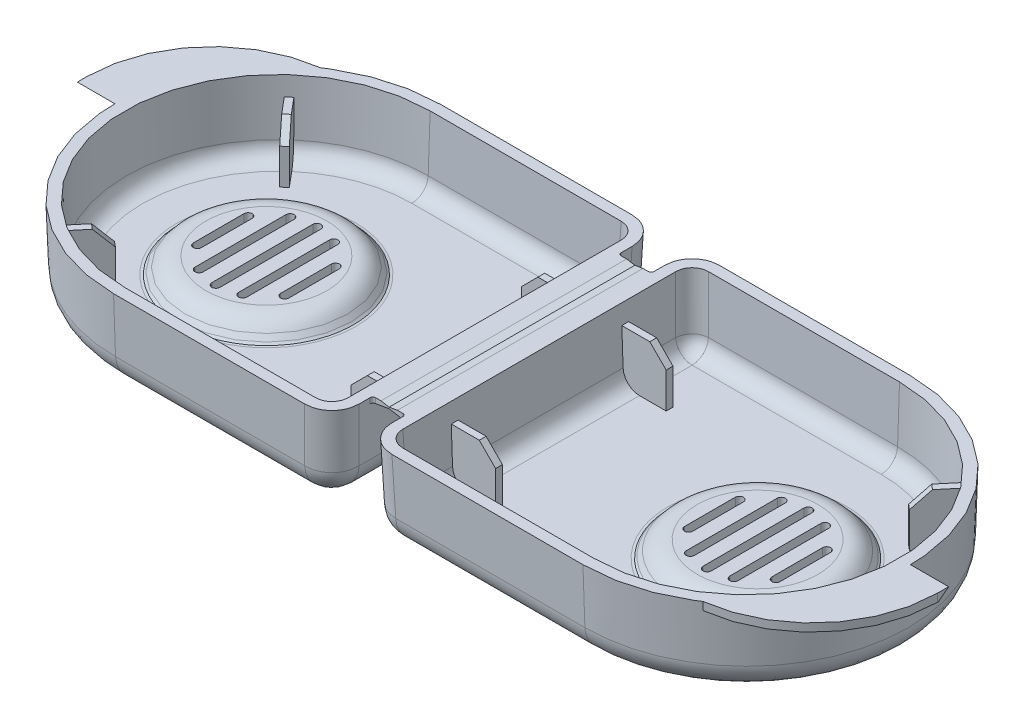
SolidWorks part; units mm, degrees
ref_plane "Front Plane" through (0, 0, 0) normal (0, 0, 1) x (1, 0, 0)
ref_plane "Top Plane" through (0, 0, 0) normal (0, 1, 0) x (1, 0, 0)
ref_plane "Right Plane" through (0, 0, 0) normal (1, 0, 0) x (0, 0, -1)
sketch "MainProfile" plane through (0, 0, 0) normal (0, 1, 0) x (1, 0, 0)
  line L0 (0, 30) -> (0, -30) construction
  line L1 (3, 30) -> (3, -30)
  line L2 (-73, 0) -> (73, 0) construction
  line L3 (3, 30) -> (43, 30)
  line L4 (-73, 30) -> (73, 30) construction
  line L5 (-73, 30) -> (-73, -30) construction
  line L6 (-73, -30) -> (73, -30) construction
  line L7 (73, 30) -> (73, -30) construction
  line L8 (43, -30) -> (3, -30)
  arc A0 (43, 30) -> (43, -30) centre (43, 0) cw
  dimension "D1" = 60
  dimension "D2" = 70
  dimension "D3" = 3
ref_plane "Ribheight" through (0, -3.5, 0) normal (0, 1, 0) x (1, 0, 0)
sketch "Sketch2" plane through (0, 0, 0) normal (0, 1, 0) x (1, 0, 0)
  line L0 (43, -30) -> (3, -30) construction
  line L1 (3, 30) -> (3, -30) construction
  line L2 (3, 30) -> (43, 30) construction
  line L3 (43, -30) -> (3, -30)
  line L4 (3, 30) -> (3, -30)
  line L5 (3, 30) -> (43, 30)
  arc A0 (43, -30) -> (43, 30) centre (43, 0) ccw construction
  arc A1 (43, -30) -> (43, 30) centre (43, 0) ccw
extrude "Boss-Extrude1" add sketch "Sketch2" against normal blind 15 draft 2
fillet "Fillet1" radius 5 6 edges at (23.2619, -15, -29.4762) (3.5238, -15, 0) (23.2619, -15, 29.4762) (72.4762, -15, 0) (3.2619, -7.5, -29.7381) (3.2619, -7.5, 29.7381)
sketch "Sketch3" plane through (0, -15, 0) normal (0, -1, 0) x (1, 0, 0)
  line L0 (0, 0) -> (45, 0) construction
  circle A0 centre (45, 0) radius 15
  dimension "D1" = 30
  dimension "D2" = 45
extrude "Cut-Extrude1" cut sketch "Sketch3" against normal blind 3 draft 40 contours A0
fillet "Fillet2" radius 3 2 edges at (45, -15, -15) (45, -12, -12.4827)
shell "Shell1" thickness 2
sketch "HingeS" plane through (2.9963, 0.1046, 0) normal (-0.9994, -0.0349, 0) x (0, 0, 1)
  line L1 (-25.003, -0.1047) -> (24.9681, -0.1047)
  line L2 (-25.003, -0.1047) -> (-25.003, -1.1047)
  line L3 (-25.003, -1.1047) -> (24.9681, -1.1047)
  line L4 (24.9681, -0.1047) -> (24.9681, -1.1047)
  line L5 (24.6477, -10.2854) -> (25.003, -0.1047) construction
  dimension "D1" = 1
sketch "Sketch4" plane through (0, -10, 0) normal (0, -1, 0) x (1, 0, 0)
  line L0 (45, 9.25) -> (45, -9.25) construction
  line L1 (45.75, 9.25) -> (45.75, -9.25)
  line L2 (44.25, 9.25) -> (44.25, -9.25)
  line L3 (49, -8.3404) -> (49, 8.3404) construction
  line L4 (48.25, -8.3404) -> (48.25, 8.3404)
  line L5 (49.75, -8.3404) -> (49.75, 8.3404)
  line L6 (53, -4.6435) -> (53, 4.6435) construction
  line L7 (52.25, -4.6435) -> (52.25, 4.6435)
  line L8 (53.75, -4.6435) -> (53.75, 4.6435)
  line L9 (45, -6.677) -> (45, -19.9204) construction
  line L10 (37, -4.6435) -> (37, 4.6435) construction
  line L11 (37.75, -4.6435) -> (37.75, 4.6435)
  line L12 (36.25, -4.6435) -> (36.25, 4.6435)
  line L13 (41, -8.3404) -> (41, 8.3404) construction
  line L14 (41.75, -8.3404) -> (41.75, 8.3404)
  line L15 (40.25, -8.3404) -> (40.25, 8.3404)
  circle A0 centre (45, 0) radius 10 construction
  arc A1 (45.75, 9.25) -> (44.25, 9.25) centre (45, 9.25) ccw
  arc A2 (44.25, -9.25) -> (45.75, -9.25) centre (45, -9.25) ccw
  arc A3 (48.25, -8.3404) -> (49.75, -8.3404) centre (49, -8.3404) ccw
  arc A4 (49.75, 8.3404) -> (48.25, 8.3404) centre (49, 8.3404) ccw
  arc A5 (52.25, -4.6435) -> (53.75, -4.6435) centre (53, -4.6435) ccw
  arc A6 (53.75, 4.6435) -> (52.25, 4.6435) centre (53, 4.6435) ccw
  arc A7 (37.75, -4.6435) -> (36.25, -4.6435) centre (37, -4.6435) cw
  arc A8 (36.25, 4.6435) -> (37.75, 4.6435) centre (37, 4.6435) cw
  arc A9 (41.75, -8.3404) -> (40.25, -8.3404) centre (41, -8.3404) cw
  arc A10 (40.25, 8.3404) -> (41.75, 8.3404) centre (41, 8.3404) cw
  point P5 (45, 0)
  point P10 (49, 0)
  point P19 (53, 0)
  point P28 (37, 0)
  point P35 (41, 0)
  dimension "D1" = 20
  dimension "D2" = 45
  dimension "D3" = 1.5
  dimension "D4" = 1.5
  dimension "D5" = 4
  dimension "D6" = 1.5
  dimension "D7" = 4
extrude "Cut-Extrude2" cut sketch "Sketch4" along normal through all draft 2
sketch "Sketch5" plane through (0, -3.5, 0) normal (0, 1, 0) x (1, 0, 0)
  line L1 (0, 0) -> (83.533, 0) construction
  line L3 (5.0012, 25.0006) -> (5.0012, -25.0006) construction
  line L4 (63.1587, 21.6408) -> (45, 0) construction
  line L6 (75.8458, -12.7842) -> (75.9294, -12.9513) construction
  line L11 (63.1587, 21.6408) -> (62.2012, 22.4442)
  line L12 (62.2012, 22.4442) -> (56.7375, 15.9329)
  line L13 (56.7375, 15.9329) -> (57.6951, 15.1294)
  line L14 (57.6951, 15.1294) -> (63.1587, 21.6408)
  line L16 (4.7512, 16.25) -> (13.2512, 16.25)
  line L17 (4.7512, 16.25) -> (4.7512, 15)
  line L18 (4.7512, 15) -> (13.2512, 15)
  line L19 (13.2512, 16.25) -> (13.2512, 15)
  dimension "D1" = 50
  dimension "D2" = 15
  dimension "D3" = 1.25
  dimension "D4" = 0.25
  dimension "D5" = 45
  dimension "D6" = 8.5
  dimension "D7" = 1.25
  dimension "D8" = 8.5
  dimension "D9" = 28.25
extrude "Rib1" add sketch "Sketch5" against normal up to body separate body
chamfer "Chamfer2" distance 3 angle 45 2 edges at (57.2163, -3.5, -15.5311) (13.2512, -3.5, -15.625)
mirror "Mirror4" about plane through (0, 0, 0) normal (0, 0, 1) of "Chamfer2", "Rib1"
mirror "Mirror3" about plane through (0, 0, 0) normal (1, 0, 0)
sketch "Sketch6" plane through (0, 0, 0) normal (0, 0, 1) x (1, 0, 0)
  line L0 (-3, 0) -> (3, 0) construction
  line L1 (3, 0) -> (3.0349, -1)
  line L2 (3.0349, -1) -> (0, -0.5)
  line L3 (0, -0.5) -> (-3.0349, -1)
  line L4 (-3.0349, -1) -> (-3, 0)
  line L5 (-3.3553, -10.1745) -> (-3, 0) construction
  line L6 (3.3553, -10.1745) -> (3, 0) construction
  line L7 (3, 0) -> (1.5, 0)
  line L8 (1.5, 0) -> (0, -0.25)
  line L9 (0, -0.25) -> (-1.5, 0)
  line L10 (-1.5, 0) -> (-3, 0)
  dimension "D1" = 0.25
  dimension "D2" = 6
  dimension "D3" = 1
  dimension "D4" = 0.25
  dimension "D5" = 1.5
extrude "Boss-Extrude6" add sketch "Sketch6" along normal mid plane 45 contours L9 L10 L4 L3 L2 L1 L7 L8
sketch "Sketch10" plane through (0, 0, 0) normal (0, 1, 0) x (1, 0, 0)
  line L0 (72, 0) -> (-93.0471, 0) construction
  line L2 (80, 0) -> (80, -2)
  line L3 (0, 0) -> (0, -48.8704) construction
  line L4 (-71.894, 0) -> (-79.894, 0)
  line L5 (-79.894, 0) -> (-79.894, 2)
  line L6 (80, 0) -> (80, 3)
  line L7 (80, 3) -> (72, 3)
  line L8 (72, 3) -> (72, 0)
  arc A1 (80, -2) -> (57.9027, -25) centre (56.9816, -2) cw
  arc A2 (57.9027, -25) -> (72, 0) centre (42.0725, 0.4012) ccw
  arc A4 (-71.894, 0) -> (-57.4866, 25) centre (-41.9007, -0.6335) cw
  arc A6 (-79.894, 2) -> (-57.4866, 25) centre (-56.8861, 2) cw
  dimension "D1" = 8
  dimension "D4" = 8
  dimension "D5" = 2
  dimension "D7" = 3
  dimension "D2" = 2
  dimension "D6" = 25
extrude "Boss-Extrude8" add sketch "Sketch10" against normal blind 5 draft 2
ref_plane "Plane1" through (-85, 0, 0) normal (-1, 0, 0) x (0, 0, 1)
sketch "Sketch11" plane through (-85, 0, 0) normal (-1, 0, 0) x (0, 0, 1)
  line L1 (-26.7397, 0) -> (-26.7397, -1.25)
  line L2 (-26.7397, -1.25) -> (-1.7397, -1.25)
  line L4 (-0.25, 0) -> (-1.7397, -1.25)
  line L5 (-0.25, 0) -> (-26.7397, 0)
  line L6 (30, 0) -> (24.8431, 0) construction
  line L9 (-26.7397, -1.25) -> (-26.7397, -5.7554)
  line L10 (-26.7397, -5.7554) -> (0, -5.7554)
  line L12 (-2, 0) -> (0, 0) construction
  line L13 (-0.25, 0) -> (0, 0)
  line L15 (0, 0) -> (0, -5.7554)
  dimension "D2" = 40
  dimension "D4" = 1.25
  dimension "D1" = 0.25
  dimension "D3" = 25
extrude "Cut-Extrude4" cut sketch "Sketch11" against normal up to surface (28.8482 mm away)
ref_plane "Plane2" through (85, 0, 0) normal (1, 0, 0) x (0, 0, -1)
sketch "Sketch13" plane through (85, 0, 0) normal (1, 0, 0) x (0, 0, -1)
  line L0 (-25.7066, 0) -> (3.5, 0) construction
  line L1 (-1.7876, -1.5) -> (0, 0)
  line L2 (-25.7066, 0) -> (-25.7066, -1.5) construction
  line L3 (-25.7066, -1.5) -> (-1.7876, -1.5)
  line L5 (-25.7066, -1.5) -> (-25.7066, -5.7632)
  line L6 (-25.7066, -5.7632) -> (3.5, -5.7632)
  line L7 (3.5, -5.7632) -> (3.5, 0)
  line L8 (0, 0) -> (3.5, 0)
  dimension "D1" = 1.5
  dimension "D2" = 40
  dimension "D3" = 3.5
extrude "Cut-Extrude5" cut sketch "Sketch13" against normal up to surface (12 mm away)
draft "Draft3" type of draft neutral plane draft angle 2 faces to draft 2 parameters "D1"=2
fillet "Fillet4" radius 0.5 4 edges at (-3.0175, -0.5, -22.5175) (3.0175, -0.5, -22.5175) (-3.0175, -0.5, 22.5175) (3.0175, -0.5, 22.5175)
